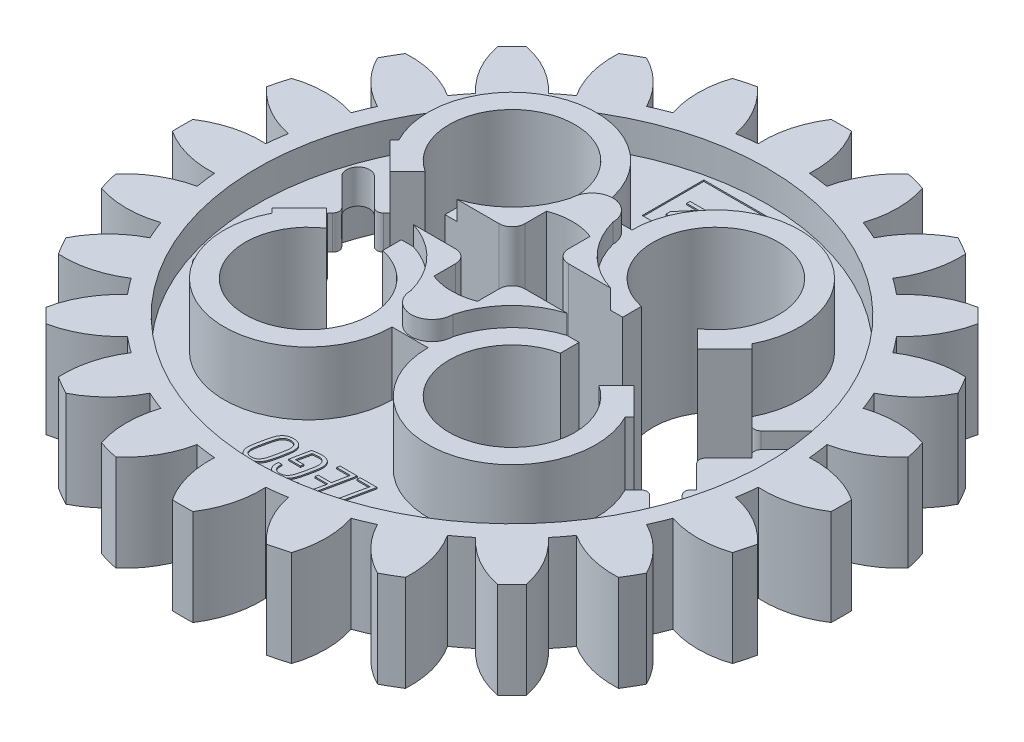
SolidWorks part; units mm, degrees
ref_plane "Plano1" through (0, 0, 0) normal (0, 0, 1) x (1, 0, 0)
ref_plane "Plano2" through (0, 0, 0) normal (0, 1, 0) x (1, 0, 0)
ref_plane "Plano3" through (0, 0, 0) normal (1, 0, 0) x (0, 0, -1)
sketch "Sketch1" plane through (0, 0, 0) normal (0, 1, 0) x (1, 0, 0)
  circle A0 centre (0, 0) radius 9.95
  dimension "D1" = 19.9
extrude "Base-Extrude" add sketch "Sketch1" along normal mid plane 1.325
sketch "Sketch3" plane through (0, 0, 0) normal (0, 1, 0) x (1, 0, 0)
  line L0 (0, 0) -> (0, 10.9099) construction
  line L1 (0, 0) -> (12.6491, 0) construction
  line L2 (-0.7, 3.975) -> (0.7, 3.975)
  line L3 (-3.975, 0.7) -> (-3.975, -0.7)
  line L4 (0.7, -3.975) -> (-0.7, -3.975)
  line L5 (3.975, -0.7) -> (3.975, 0.7)
  arc A0 (3.975, 0.7) -> (0.7, 3.975) centre (3.975, 3.975) ccw
  arc A1 (3.975, -0.7) -> (0.7, -3.975) centre (3.975, -3.975) cw
  arc A2 (-3.975, -0.7) -> (-0.7, -3.975) centre (-3.975, -3.975) ccw
  arc A3 (-3.975, 0.7) -> (-0.7, 3.975) centre (-3.975, 3.975) cw
  dimension "D1" = 6.55
  dimension "D2" = 3.975
  dimension "D3" = 3.975
extrude "Boss-Extrude1" add sketch "Sketch3" along normal mid plane 6.25
sketch "Sketch4" plane through (0, 0, 0) normal (0, 1, 0) x (1, 0, 0)
  line L0 (0, 0) -> (10.8281, 0) construction
  line L1 (-2.9952, -0.85) -> (2.9952, -0.85)
  line L7 (-2.9952, 0.85) -> (2.9952, 0.85)
  arc A0 (0.8135, 3.1201) -> (2.9952, 0.85) centre (3.975, 3.975) ccw
  arc A1 (0.8135, 3.1201) -> (-0.8135, 3.1201) centre (0, 3.1201) ccw
  arc A2 (3.975, 0.7) -> (0.7, 3.975) centre (3.975, 3.975) ccw construction
  arc A3 (-2.9952, 0.85) -> (-0.8135, 3.1201) centre (-3.975, 3.975) ccw
  arc A4 (-0.7, 3.975) -> (-3.975, 0.7) centre (-3.975, 3.975) ccw construction
  arc A5 (-2.9952, -0.85) -> (-0.8135, -3.1201) centre (-3.975, -3.975) cw
  arc A6 (0.8135, -3.1201) -> (-0.8135, -3.1201) centre (0, -3.1201) cw
  arc A7 (0.8135, -3.1201) -> (2.9952, -0.85) centre (3.975, -3.975) cw
  point P19 (0, 0.85)
  point P23 (0, -0.85)
  dimension "D1" = 6.55
  dimension "D2" = 6.55
extrude "Boss-Extrude2" add sketch "Sketch4" along normal mid plane 7.75
sketch "Sketch5" plane through (0, 0, 0) normal (0, 1, 0) x (1, 0, 0)
  line L0 (0, 0) -> (13.8248, 0) construction
  line L1 (3.7514, -1.0486) -> (4.9535, -2.2507)
  line L2 (3.3941, 15.0397) -> (3.3941, 10.3397)
  line L3 (5.0941, 15.0397) -> (5.0941, 10.3397)
  line L4 (7.0748, 2.2748) -> (6, 1.2)
  line L5 (3.3941, 1.9112) -> (5.0941, 1.9112)
  line L6 (7.0574, 2.2922) -> (7.3576, 1.992)
  line L7 (9.2309, -2.5925) -> (7.994, -1.3556)
  line L8 (7.0574, 2.2922) -> (6, 1.2348)
  line L9 (8.2769, -1.0727) -> (7.2042, 0)
  line L10 (8.5945, -3.2289) -> (7.3576, -1.992)
  line L11 (7.994, -1.3556) -> (8.2769, -1.0727)
  line L12 (7.2042, 0) -> (8.2769, 1.0727)
  line L13 (7.0574, -2.2922) -> (6, -1.2348)
  line L14 (3.3941, 6.6112) -> (5.0941, 6.6112)
  line L15 (7.0574, -2.2922) -> (7.3576, -1.992)
  line L16 (4.9252, -2.3096) -> (3.4656, -2.3096)
  line L17 (8.2769, 1.0727) -> (7.2021, -0.0021)
  line L18 (4.9252, -2.3096) -> (6, -1.2348)
  line L19 (3.4656, -0.85) -> (3.4656, -2.3096)
  line L20 (0, 0) -> (0, 3.2289) construction
  line L21 (3.4656, 0.85) -> (3.4656, 2.3096)
  line L22 (-4.9252, 2.3096) -> (-3.4656, 2.3096)
  line L23 (0.85, 0.85) -> (3.4656, 0.85)
  line L24 (4.9252, 2.3096) -> (6, 1.2348)
  line L25 (-9.2309, 2.5925) -> (-7.994, 1.3556)
  line L26 (4.9252, 2.3096) -> (3.4656, 2.3096)
  line L27 (-8.5945, 3.2289) -> (-7.3576, 1.992)
  line L28 (0.85, 2.1963) -> (0.85, 0.85)
  line L29 (0.85, -0.85) -> (3.4656, -0.85)
  line L30 (0.85, -0.85) -> (0.85, -2.1963)
  line L31 (-7.994, 1.3556) -> (-8.2769, 1.0727)
  line L32 (-0.85, -0.85) -> (-0.85, -2.1963)
  line L33 (-3.4656, 0.85) -> (-3.4656, 2.3096)
  line L34 (-0.85, 2.1963) -> (-0.85, 0.85)
  line L35 (-4.9252, 2.3096) -> (-6, 1.2348)
  line L36 (-4.9252, -2.3096) -> (-3.4656, -2.3096)
  line L37 (-3.4656, -0.85) -> (-3.4656, -2.3096)
  line L38 (7.994, 1.3556) -> (8.2769, 1.0727)
  line L39 (8.5945, 3.2289) -> (7.3576, 1.992)
  line L40 (9.2309, 2.5925) -> (7.994, 1.3556)
  line L41 (-0.85, -0.85) -> (-3.4656, -0.85)
  line L42 (-0.85, 0.85) -> (-3.4656, 0.85)
  line L43 (-4.9252, -2.3096) -> (-6, -1.2348)
  line L45 (-7.0574, -2.2922) -> (-7.3576, -1.992)
  line L46 (-7.0574, -2.2922) -> (-6, -1.2348)
  line L47 (-7.2042, 0) -> (-8.2769, 1.0727)
  line L48 (-7.994, -1.3556) -> (-8.2769, -1.0727)
  line L49 (-8.5945, -3.2289) -> (-7.3576, -1.992)
  line L50 (-8.2769, -1.0727) -> (-7.2042, 0)
  line L51 (-7.0574, 2.2922) -> (-6, 1.2348)
  line L52 (-9.2309, -2.5925) -> (-7.994, -1.3556)
  line L53 (-7.0574, 2.2922) -> (-7.3576, 1.992)
  arc A0 (9.2309, 2.5925) -> (8.5945, 3.2289) centre (8.9127, 2.9107) ccw
  arc A1 (9.2309, -2.5925) -> (8.5945, -3.2289) centre (8.9127, -2.9107) cw
  arc A2 (-9.2309, -2.5925) -> (-8.5945, -3.2289) centre (-8.9127, -2.9107) ccw
  arc A3 (-9.2309, 2.5925) -> (-8.5945, 3.2289) centre (-8.9127, 2.9107) cw
  arc A4 (-0.85, -2.1963) -> (0.85, -2.1963) centre (0, 0) ccw
  arc A5 (0.85, 2.1963) -> (-0.85, 2.1963) centre (0, 0) ccw
  dimension "D4" = 0.85
  dimension "D6" = 0.9
extrude "Cut-Extrude1" cut sketch "Sketch5" against normal through all and the other way through all
sketch "Sketch6" plane through (0, 0, 0) normal (0, 1, 0) x (1, 0, 0)
  line L0 (0, 0) -> (14.1851, 0) construction
  line L1 (0, 0) -> (0, 12.6527) construction
  circle A0 centre (3.975, 3.975) radius 2.45
  circle A1 centre (3.975, -3.975) radius 2.45
  arc A2 (5.9054, 1.3294) -> (0.7, 3.975) centre (3.975, 3.975) ccw construction
  circle A3 centre (-3.975, -3.975) radius 2.45
  circle A5 centre (-3.975, 3.975) radius 2.45
  dimension "D1" = 4.9
extrude "Cut-Extrude2" cut sketch "Sketch6" against normal through all and the other way through all
sketch "Sketch7" plane through (0, 0, 0) normal (0, 1, 0) x (1, 0, 0)
  circle A0 centre (0, 0) radius 9.95 construction
  circle A1 centre (0, 0) radius 9.95
  circle A2 centre (0, 0) radius 10.65
  dimension "D1" = 21.3
extrude "Boss-Extrude3" add sketch "Sketch7" along normal mid plane 3.75
sketch "Sketch9" plane through (0, 0, 0) normal (0, 1, 0) x (1, 0, 0)
  line L0 (0, 0) -> (0, 18.7656) construction
  circle A0 centre (0, 0) radius 10.65 construction
  arc A1 (1, 10.6029) -> (-1, 10.6029) centre (0, 0) ccw
  arc A2 (0.4, 12.8438) -> (-0.4, 12.8438) centre (0, 0) ccw
  arc A3 (1, 10.6029) -> (0.4, 12.8438) centre (-2.7373, 10.803) ccw
  arc A4 (-1, 10.6029) -> (-0.4, 12.8438) centre (2.7373, 10.803) cw
  dimension "D1" = 25.7
extrude "Boss-Extrude4" add sketch "Sketch9" against normal mid plane 3.75
pattern_circular "CirPattern1" count 24 every 15 about axis through (0, 0, 0) along (0, 1, 0) of "Boss-Extrude4"
sketch "Sketch10" plane through (0, 0, 0) normal (0, 1, 0) x (1, 0, 0)
  line L0 (6, 1.2348) -> (5.9054, 1.3294) construction
  line L1 (6, 1.2348) -> (5.9054, 1.3294)
  line L2 (7.3576, 1.992) -> (7.0574, 2.2922) construction
  line L3 (7.0574, 2.2922) -> (6.8823, 2.4673)
  line L4 (7.0574, 2.2922) -> (6, 1.2348) construction
  line L5 (7.0574, 2.2922) -> (6, 1.2348)
  arc A1 (5.9054, 1.3294) -> (0.7, 3.975) centre (3.975, 3.975) ccw construction
  arc A2 (5.9054, 1.3294) -> (6.8823, 2.4673) centre (3.975, 3.975) ccw
extrude "Boss-Extrude5" add sketch "Sketch10" along normal mid plane 6.25
mirror "Mirror1" about plane through (0, 0, 0) normal (0, 0, 1) of "Boss-Extrude5"
mirror "Mirror6" about plane through (0, 0, 0) normal (1, 0, 0) of "Mirror1", "Boss-Extrude5"
fillet "Fillet2" radius 0.25 10 edges at (-7.2042, 0, 0) (-7.994, 0, 1.3556) (-7.994, 0, -1.3556) (-7.3576, 0, 1.992) (-7.3576, 0, -1.992) (7.3576, 0, -1.992) (7.3576, 0, 1.992) (7.994, 0, 1.3556) (7.994, 0, -1.3556) (7.2042, 0, 0)
sketch "Sketch12" plane through (0, 0.6625, 0) normal (0, 1, 0) x (-1, 0, 0)
  line L0 (0, 0) -> (0, -13.9615) construction
  line L2 (2.05, -9.5292) -> (-2.05, -9.5292)
  line L3 (2.05, -9.5292) -> (2.05, -7.1292)
  line L4 (2.05, -7.1292) -> (-2.05, -7.1292)
  line L5 (-2.05, -9.5292) -> (-2.05, -7.1292)
  dimension "D1" = 4.1
  dimension "D2" = 2.05
  dimension "D3" = 2.4
extrude "Cut-Extrude3" cut sketch "Sketch12" against normal blind 0.05
sketch "Sketch13" plane through (3.1039, 0.6125, -7.1481) normal (0, 1, 0) x (1, 0, 0)
  text T0 "z24" font "OCR-B 10 BT" height in points 6
extrude "Boss-Extrude7" add sketch "Sketch13" along normal blind 0.05
sketch "Sketch14" plane through (0.4066, 0.6625, 8.2685) normal (0, 1, 0) x (-1, 0, 0)
  text T0 "LEGO" font "Zurich LtCn BT" height in points 6
extrude "Boss-Extrude8" add sketch "Sketch14" along normal blind 0.05
fillet "Fillet3" radius 0.5 4 edges at (0.85, 0, -0.85) (-0.85, 0, 0.85) (0.85, 0, 0.85) (-0.85, 0, -0.85)
